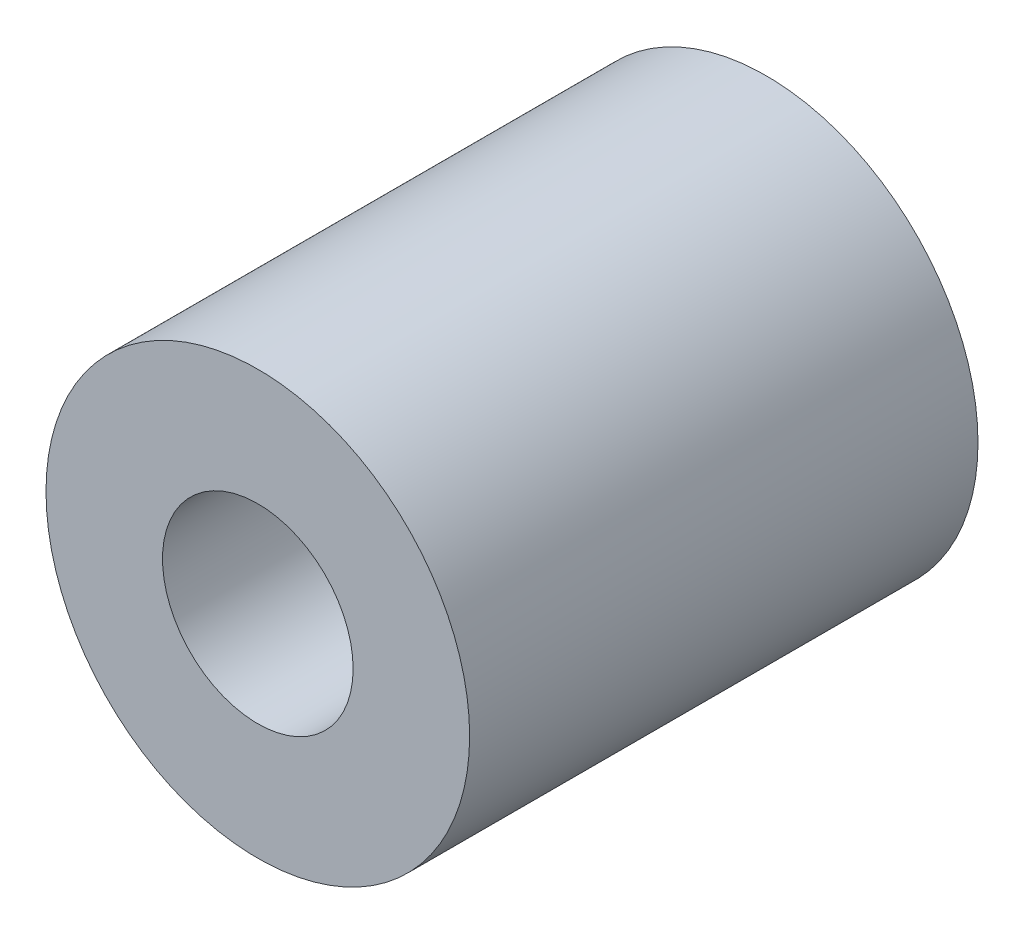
SolidWorks part; units mm, degrees
ref_plane "Front Plane" through (0, 0, 0) normal (0, 0, 1) x (1, 0, 0)
ref_plane "Top Plane" through (0, 0, 0) normal (0, 1, 0) x (1, 0, 0)
ref_plane "Right Plane" through (0, 0, 0) normal (1, 0, 0) x (0, 0, -1)
sketch "Sketch1" plane through (0, 0, 0) normal (0, 0, 1) x (1, 0, 0)
  circle A0 centre (0, 0) radius 2.25
  circle A1 centre (0, 0) radius 5
  dimension "D1" = 4.5
  dimension "D2" = 10
extrude "Extrude1" add sketch "Sketch1" along normal blind 12
